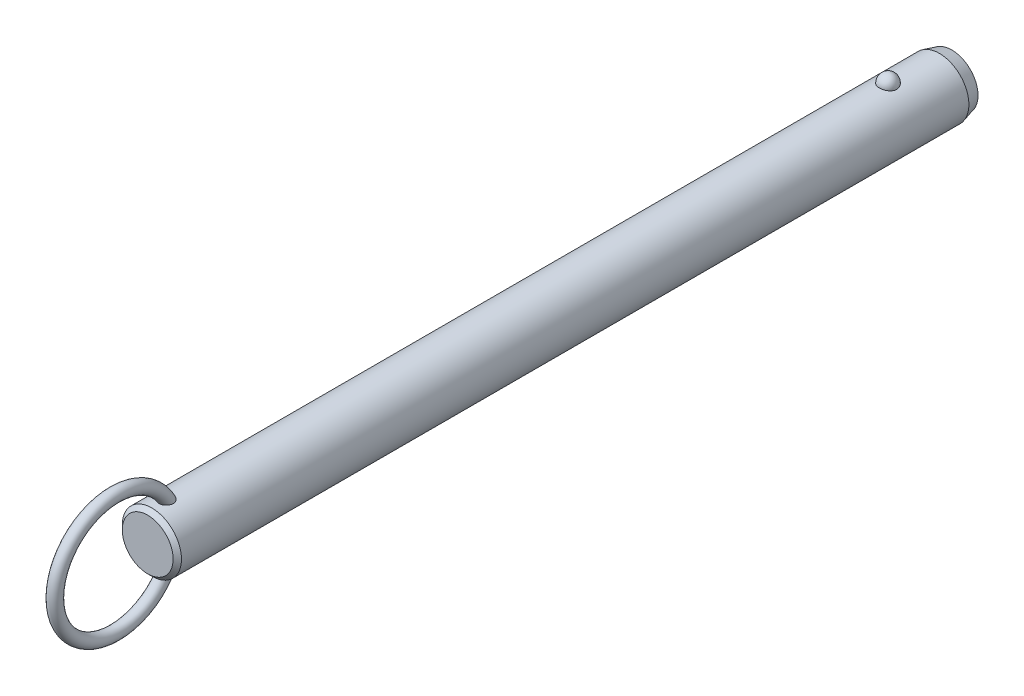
SolidWorks part; units mm, degrees
ref_plane "Front Plane" through (0, 0, 0) normal (0, 0, 1) x (1, 0, 0)
ref_plane "Top Plane" through (0, 0, 0) normal (0, 1, 0) x (1, 0, 0)
ref_plane "Right Plane" through (0, 0, 0) normal (1, 0, 0) x (0, 0, -1)
sketch "Sketch2" plane through (0, 0, 0) normal (0, 0, 1) x (1, 0, 0)
  circle A0 centre (0, 0) radius 7.1
  point P3 (0, 7.1)
  dimension "D1" = 14.2
extrude "Boss-Extrude1" add sketch "Sketch2" along normal blind 167.6
sketch "Sketch3" plane through (0, 0, 0) normal (0, 0, -1) x (-1, 0, 0)
  circle A0 centre (0, 0) radius 7.1
  dimension "D1" = 14.2
extrude "Boss-Extrude2" add sketch "Sketch3" along normal blind 17.4
chamfer "Chamfer1" distance 3 angle 15 1 edges at (-7.1, 0, -17.4)
sketch "Sketch12" plane through (0, 0, 0) normal (1, 0, 0) x (0, 0, -1)
  line L0 (-167.6, 7.1) -> (-167.6, -7.1) construction
  point P0 (-167.6, 0)
sketch "Sketch13" plane through (0, 0, 0) normal (1, 0, 0) x (0, 0, -1)
  circle A0 centre (-183.45, 0) radius 15.85
  point P2 (-167.6, 0)
  dimension "D1" = 31.7
sketch "Sketch14" plane through (0, 0, 0) normal (0, 1, 0) x (1, 0, 0)
  circle A0 centre (0, -169.1) radius 1.5
  point P2 (0, -167.6)
  dimension "D1" = 3
sweep "Sweep1" add profiles "Sketch14" path "Sketch13"
sketch "Sketch15" plane through (0, 0, 167.6) normal (0, 0, 1) x (1, 0, 0)
  circle A0 centre (0, 0) radius 7.1
  dimension "D1" = 14.2
extrude "Boss-Extrude3" add sketch "Sketch15" along normal blind 7.92
chamfer "Chamfer2" distance 1 angle 45 1 edges at (7.1, 0, 175.52)
sketch "Sketch18" plane through (0, 0, 0) normal (1, 0, 0) x (0, 0, -1)
  line L0 (14.4, 7.1) -> (-169.2792, 7.1) construction
  line L1 (2.1, 9.2) -> (2.1, 5)
  line L2 (-169.2792, -7.1) -> (14.4, -7.1) construction
  arc A0 (2.1, 9.2) -> (2.1, 5) centre (2.1, 7.1) ccw
  point P4 (0, 7.1)
  dimension "D1" = 16.3
revolve "Revolve1" add sketch "Sketch18" angle 360 about L1
